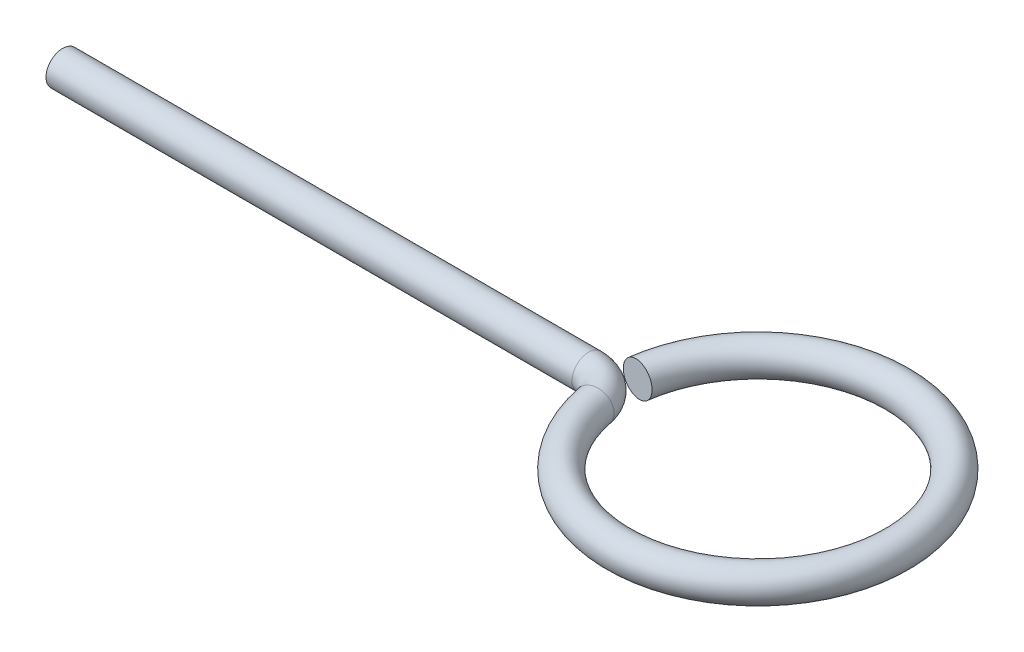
SolidWorks part; units mm, degrees
ref_plane "Front" through (0, 0, 0) normal (0, 0, 1) x (1, 0, 0)
ref_plane "Top" through (0, 0, 0) normal (0, 1, 0) x (1, 0, 0)
ref_plane "Right" through (0, 0, 0) normal (1, 0, 0) x (0, 0, -1)
sketch "Sketch1" plane through (0, 0, 0) normal (0, 1, 0) x (1, 0, 0)
  line L0 (0, 0) -> (47.2931, 0)
  arc A0 (50.2364, -2.4194) -> (50.1024, 1.5967) centre (62.5, 0) ccw
  arc A1 (50.2364, -2.4194) -> (47.2931, 0) centre (47.2931, -3) ccw
sketch3d "3DSketch1"
  circle A0 centre (0, 0, 0) radius 1.5
  point P2 (1.5, 0, 0)
sweep "Sweep4" add profiles "3DSketch1" path "Sketch1"
